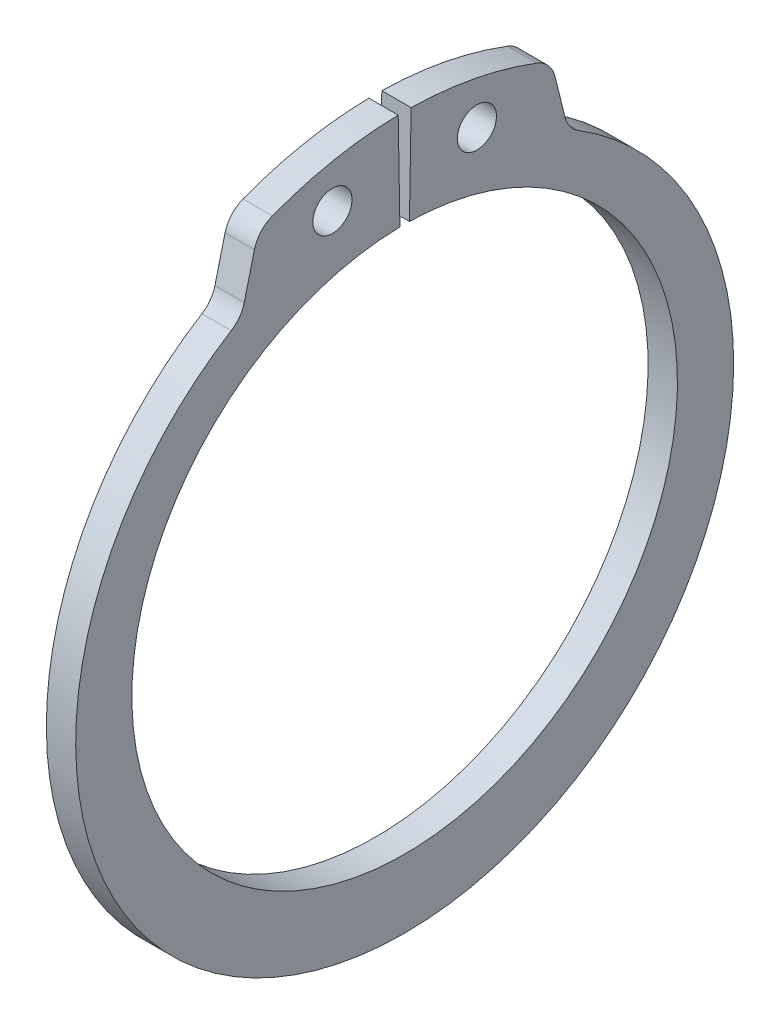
SolidWorks part; units mm, degrees
ref_plane "Front" through (0, 0, 0) normal (0, 0, 1) x (1, 0, 0)
ref_plane "Top" through (0, 0, 0) normal (0, 1, 0) x (1, 0, 0)
ref_plane "Right" through (0, 0, 0) normal (1, 0, 0) x (0, 0, -1)
sketch "Sketch1" plane through (0, 0, 0) normal (1, 0, 0) x (0, 0, -1)
  line L0 (0, 0) -> (0, 13.95) construction
  line L1 (-0.2435, 13.9479) -> (-0.3307, 18.9471)
  line L2 (-0.3307, 18.9471) -> (-7.145, 18.8282) construction
  line L3 (-7.145, 18.8282) -> (-8.3546, 13.9767) construction
  line L4 (0.3307, 18.9471) -> (0.2435, 13.9479)
  line L5 (0.3307, 18.9471) -> (7.145, 18.8282) construction
  line L6 (7.145, 18.8282) -> (8.3546, 13.9767) construction
  line L7 (-8.3546, 13.9767) -> (-7.1574, 11.9739) construction
  line L8 (8.3546, 13.9767) -> (7.1574, 11.9739) construction
  line L9 (0, -13.95) -> (0, -17.45) construction
  line L10 (-7.145, 18.8282) -> (-0.2435, 13.9479) construction
  line L11 (-13.95, 0) -> (13.95, 0) construction
  line L12 (0, 13.95) -> (0, 18.95) construction
  line L13 (7.5004, 17.4025) -> (8.3546, 13.9767)
  line L14 (-7.5004, 17.4025) -> (-8.3546, 13.9767)
  circle A0 centre (0, 0) radius 13.95 construction
  arc A1 (-0.2435, 13.9479) -> (0.2435, 13.9479) centre (0, 0) ccw
  circle A2 centre (0, -0.6261) radius 16.8239 construction
  circle A4 centre (-3.6942, 16.388) radius 1
  circle A5 centre (3.6942, 16.388) radius 1
  arc A6 (-8.3546, 13.9767) -> (8.3546, 13.9767) centre (0, -0.6261) ccw
  arc A7 (0.3307, 18.9471) -> (7.5004, 17.4025) centre (0, 0) cw
  arc A8 (-0.3307, 18.9471) -> (-7.5004, 17.4025) centre (0, 0) ccw
  dimension "D1" = 75
  dimension "A" = 27.9
  dimension "Hole" = 2
  dimension "Smin" = 2.3333
  dimension "Smax" = 3.5
  dimension "H" = 5
  dimension "Angle" = 1
extrude "Extrude1" add sketch "Sketch1" along normal mid plane 1.5
fillet "Fillet1" radius 1.5 4 edges at (0, 13.9767, 8.3546) (0, 17.4025, 7.5004) (0, 17.4025, -7.5004) (0, 13.9767, -8.3546)
sketch "Sketch2" plane through (0, 0, 0) normal (0, 0, 1) x (1, 0, 0)
  line L0 (-4, 0) -> (12, 0)
  line L1 (12, 0) -> (12, -15)
  line L2 (-4, 0) -> (-4, -14.3)
  line L3 (12, -15) -> (0.8, -15)
  line L4 (0.8, -15) -> (0.8, -14.3)
  line L5 (0.8, -14.3) -> (-0.8, -14.3)
  line L6 (-0.8, -14.3) -> (-0.8, -15)
  line L7 (-0.8, -15) -> (-4, -15) construction
  line L8 (-4, -15) -> (-4, 0) construction
  line L9 (0, -14.3) -> (0, 0) construction
  line L10 (12, 0) -> (14.0551, 0) construction
  line L11 (-4, -14.3) -> (-3.3, -15)
  line L12 (-3.3, -15) -> (-0.8, -15)
  dimension "D1" = 45
  dimension "Dg" = 28.6
  dimension "Ds" = 30
  dimension "D2" = 16
  dimension "W" = 1.6
  dimension "D3" = 4
revolve "Revolve1" [suppressed] add sketch "Sketch2" angle 360 about L10
equation "\"D2@Sketch2\" = \"W@Sketch2\"*10"
equation "\"D3@Sketch2\" = \"D2@Sketch2\"/4"
equation "\"Smin@Sketch1\" = \"Smax@Sketch1\"/1.5"
equation "\"D1@Fillet1\" = \"D1@Extrude1\""
